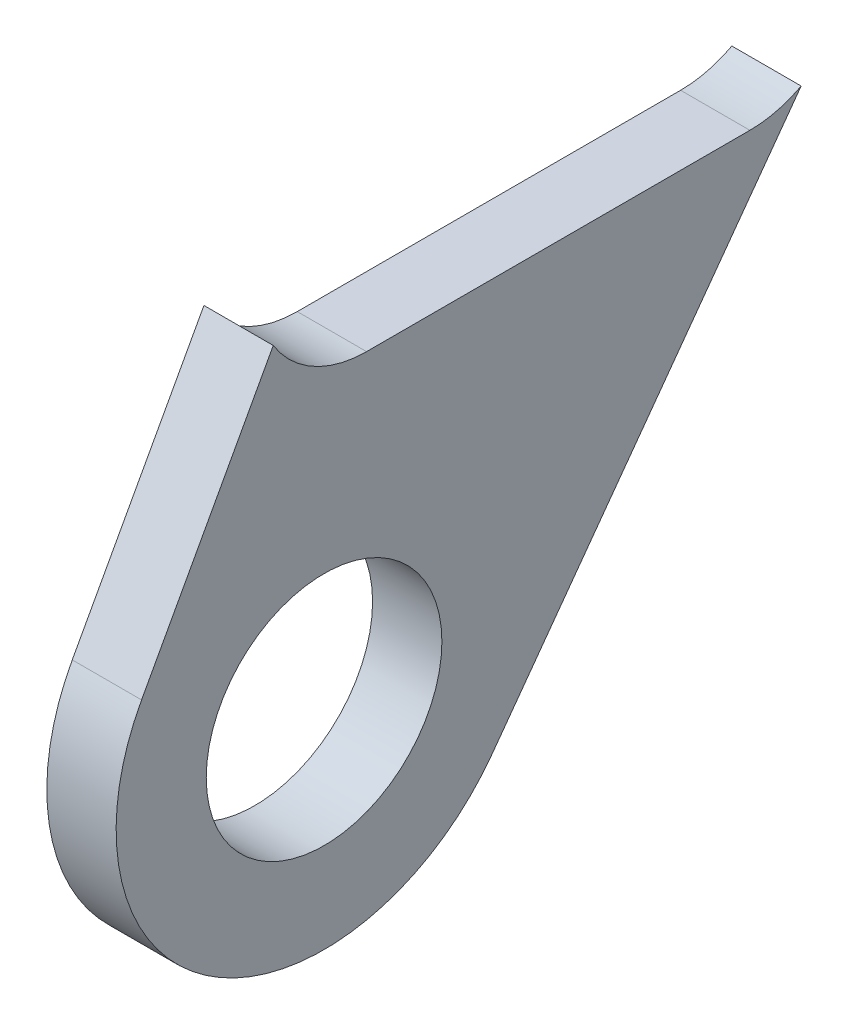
SolidWorks part; units mm, degrees
ref_plane "Plan de face" through (0, 0, 0) normal (0, 0, 1) x (1, 0, 0)
ref_plane "Plan de dessus" through (0, 0, 0) normal (0, 1, 0) x (1, 0, 0)
ref_plane "Plan de droite" through (0, 0, 0) normal (1, 0, 0) x (0, 0, -1)
sketch "Esquisse1" plane through (0, 0, 0) normal (1, 0, 0) x (0, 0, -1)
  line L0 (-15.7981, 8.6267) -> (-4.4, 29.5)
  line L1 (3.6777, 25) -> (36.8627, 25)
  line L2 (41.3, 26.1) -> (14.5457, -10.603)
  circle A0 centre (0, 0) radius 10.2
  arc A1 (-15.7981, 8.6267) -> (14.5457, -10.603) centre (0, 0) ccw
  arc A2 (-4.4, 29.5) -> (3.6777, 25) centre (3.6777, 34.5) ccw
  arc A3 (36.8627, 25) -> (41.3, 26.1) centre (36.8627, 34.5) ccw
  dimension "D1" = 20.4
  dimension "D2" = 18
  dimension "D3" = 9.5
  dimension "D4" = 9.5
  dimension "D5" = 45.7
  dimension "D6" = 4.4
  dimension "D7" = 25
  dimension "D8" = 4.5
  dimension "D9" = 1.1
extrude "Extrusion1" add sketch "Esquisse1" along normal blind 6
